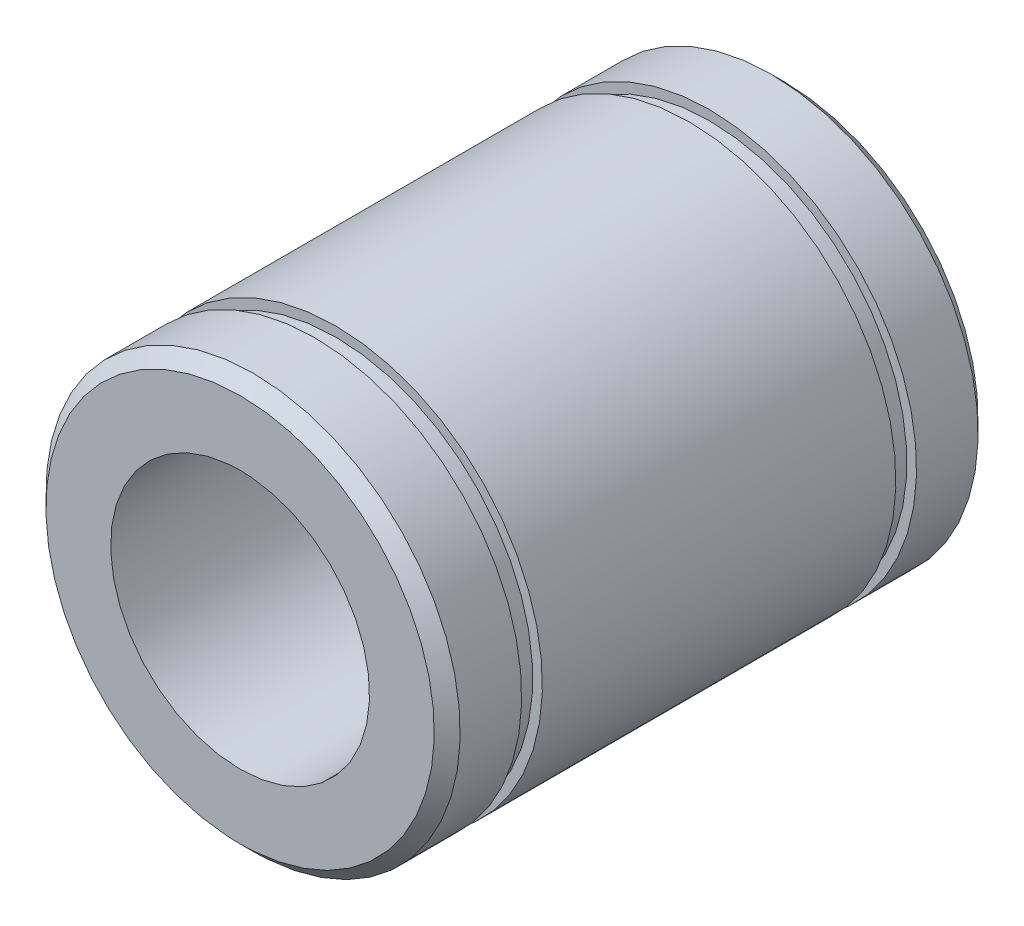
SolidWorks part; units mm, degrees
other "Solid1"
ref_plane "Front Plane" through (0, 0, 0) normal (0, 0, 1) x (1, 0, 0)
ref_plane "Top Plane" through (0, 0, 0) normal (0, 1, 0) x (1, 0, 0)
ref_plane "Right Plane" through (0, 0, 0) normal (1, 0, 0) x (0, 0, -1)
imported_body "2.7010 LM20UU.stp<1>"
move or copy body "Body-Move/Copy1" bodies to move or copy 101 copy no rotation origin (0, 21, 0) rotation axis (1, 0, 0) rotation angle 90
